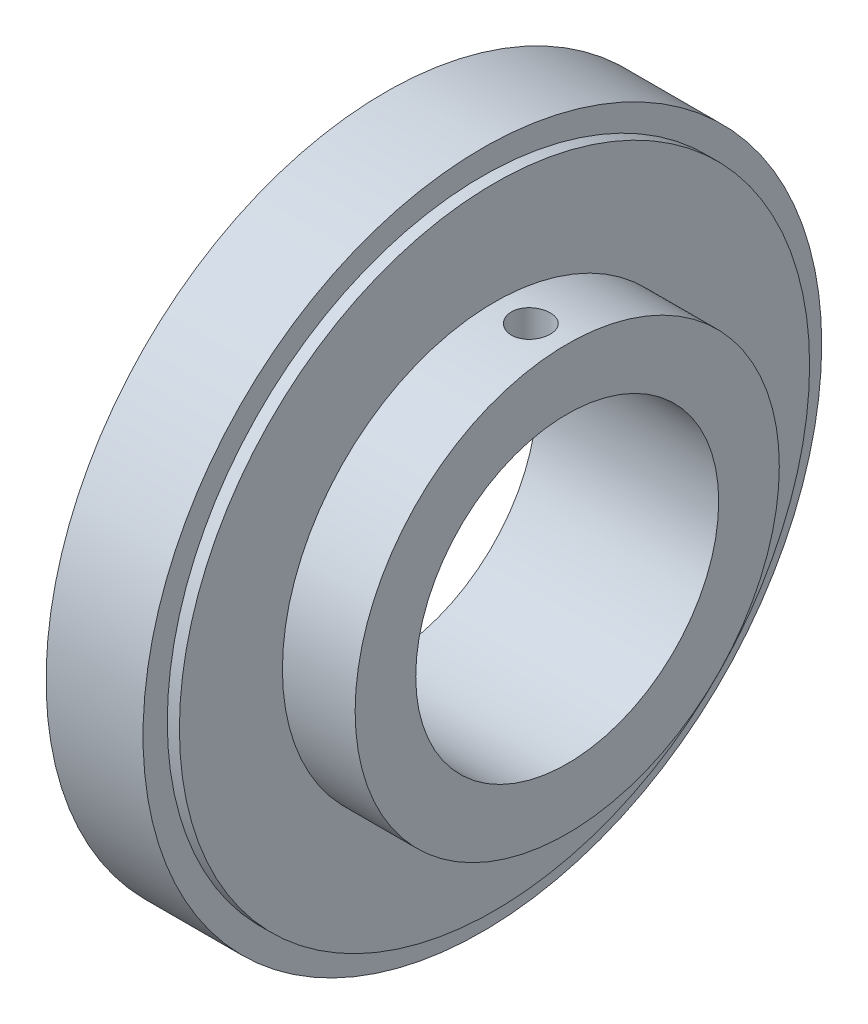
SolidWorks part; units mm, degrees
ref_plane "Face" through (0, 0, 0) normal (0, 0, 1) x (1, 0, 0)
ref_plane "Dessus" through (0, 0, 0) normal (0, 1, 0) x (1, 0, 0)
ref_plane "Droite" through (0, 0, 0) normal (1, 0, 0) x (0, 0, -1)
sketch "Esquisse1" plane through (0, 0, 0) normal (0, 0, 1) x (1, 0, 0)
  line L0 (0, 0) -> (-44.6492, 0) construction
  line L1 (0, 12.5) -> (0, 17.5)
  line L2 (0, 17.5) -> (-6, 17.5)
  line L3 (-15, 17.5) -> (-15, 12.5)
  line L4 (0, 12.5) -> (-15, 12.5)
  line L5 (-6, 17.5) -> (-6, 26)
  line L6 (-6, 26) -> (-7, 26)
  line L7 (-7, 26) -> (-7, 17.5)
  line L8 (-7, 17.5) -> (-15, 17.5)
  dimension "D1" = 15
  dimension "D2" = 35
  dimension "D3" = 25
  dimension "D4" = 52
  dimension "D5" = 6
  dimension "D6" = 8
revolve "Révolution1" add sketch "Esquisse1" angle 360 about L0
sketch "Esquisse2" plane through (0, 0, 0) normal (0, 0, 1) x (1, 0, 0)
  line L0 (-7, 17.5) -> (-15, 17.5)
  line L1 (-15, 17.5) -> (-15, 28)
  line L2 (-15, 28) -> (-7, 28)
  line L3 (-7, 28) -> (-7, 17.5)
  line L4 (0, 0) -> (-17.4695, 0) construction
  dimension "D1" = 56
revolve "Révolution2" add sketch "Esquisse2" angle 360 about L4
sketch "Esquisse3" plane through (0, 0, 0) normal (0, 0, 1) x (1, 0, 0)
  line L0 (-4.6, 19) -> (-4.6, 10)
  line L1 (-4.6, 10) -> (-3, 10)
  line L2 (-3, 10) -> (-3, 19)
  line L3 (-3, 19) -> (-4.6, 19)
  line L4 (-3, 20.5398) -> (-3, 12.544) construction
  dimension "D1" = 3
  dimension "D2" = 3.2
  dimension "D3" = 9
  dimension "D4" = 19
revolve "Enlèvement de matière-Révolution1" cut sketch "Esquisse3" angle 360 about L4
ref_plane "Plan1" through (0, 0, 0) normal (0, 0.5, 0.866) x (1, 0, 0)
ref_plane "Plan2" through (0, 0, 0) normal (0, -0.5, 0.866) x (1, 0, 0)
